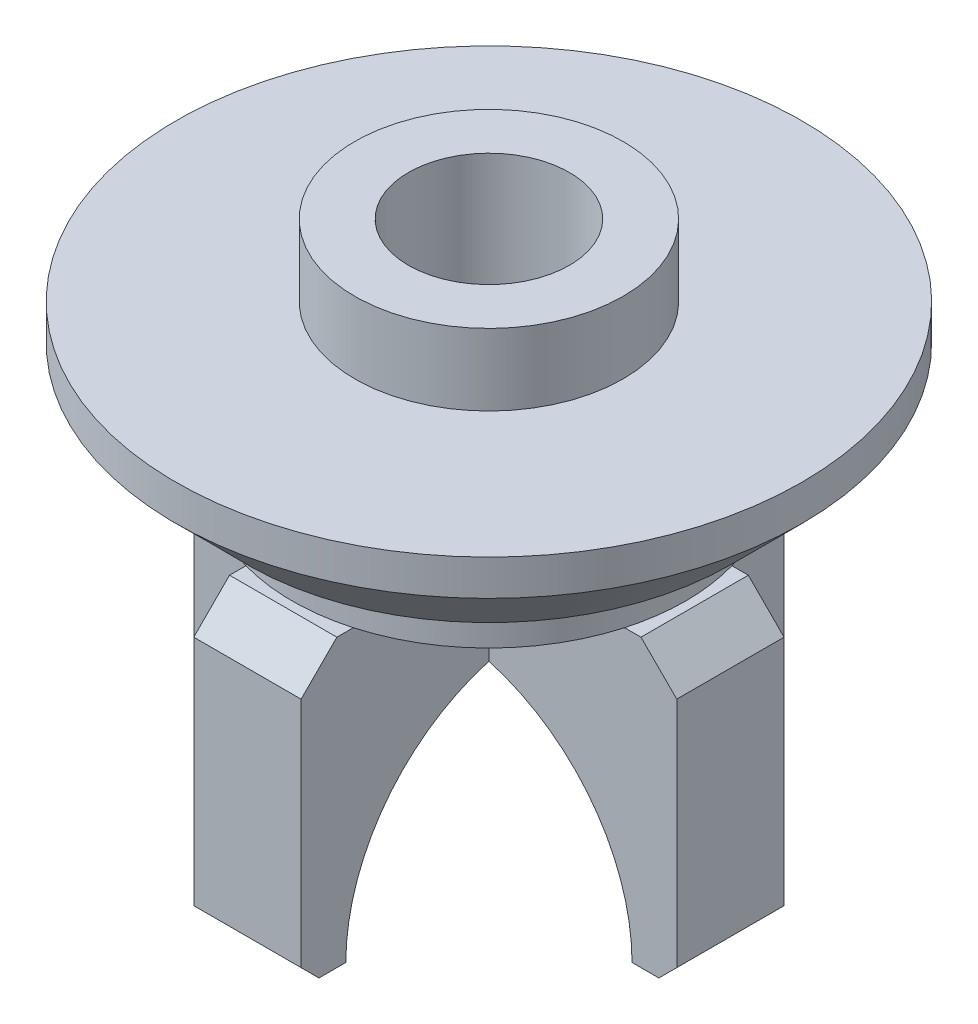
SolidWorks part; units mm, degrees
ref_plane "Front Plane" through (0, 0, 0) normal (0, 0, 1) x (1, 0, 0)
ref_plane "Top Plane" through (0, 0, 0) normal (0, 1, 0) x (1, 0, 0)
ref_plane "Right Plane" through (0, 0, 0) normal (1, 0, 0) x (0, 0, -1)
sketch "Sketch1" plane through (0, 0, 0) normal (0, 0, 1) x (1, 0, 0)
  line L0 (0, 0) -> (0, 23.9278) construction
  line L1 (0, 0) -> (24.5326, 0) construction
  line L2 (0, 0) -> (11, 0)
  line L3 (11, 0) -> (11, 3)
  line L4 (11, 3) -> (13.5, 3)
  line L5 (13.5, 3) -> (17.5, 7)
  line L6 (17.5, 7) -> (17.5, 9)
  line L7 (17.5, 9) -> (7.5, 9)
  line L8 (7.5, 9) -> (7.5, 13)
  line L9 (7.5, 13) -> (0, 13)
  line L10 (0, 0) -> (0, 13)
  dimension "D1" = 11
  dimension "D2" = 2.5
  dimension "D3" = 3
  dimension "D4" = 4
  dimension "D5" = 4
  dimension "D6" = 2
  dimension "D7" = 4
  dimension "D8" = 7.5
revolve "Revolve1" add sketch "Sketch1" angle 360 about L10
sketch "Sketch2" plane through (0, 0, 0) normal (0, 0, 1) x (1, 0, 0)
  line L0 (0, 0) -> (0, -5) construction
  line L1 (0, 0) -> (0, -5)
  line L2 (-13.5, -2) -> (-13.5, -15)
  line L3 (13.5, -2) -> (13.5, -15)
  line L4 (-11.5, 0) -> (11.5, 0)
  line L5 (-12.5, -16) -> (-11, -16)
  line L6 (11, -16) -> (12.5, -16)
  line L7 (0, 0) -> (0, -16) construction
  line L8 (13.5, 0) -> (13.5, -16) construction
  line L9 (11.5, 0) -> (13.5, -2)
  line L10 (-13.5, 0) -> (-13.5, -16) construction
  line L11 (-11.5, 0) -> (-13.5, -2)
  line L12 (-13.5, -15) -> (-12.5, -16)
  line L13 (12.5, -16) -> (13.5, -15)
  arc A0 (11, -16) -> (-11, -16) centre (0, -16) ccw
  dimension "D2" = 22
  dimension "D1" = 16
  dimension "D3" = 13.5
  dimension "D4" = 13.5
extrude "Boss-Extrude1" add sketch "Sketch2" along normal mid plane 6 contours A0 L1 L4 L11 L2 L12 L5 | A0 L6 L13 L3 L9 L4 L1
pattern_circular "CirPattern1" count 2 over 90 about axis through (0, 0, 0) along (0, 1, 0) of "Boss-Extrude1"
hole_wizard "Ø9.0 (9) Diameter Hole1" positions "Sketch3" profile "Sketch4" hole size "Ø9.0" standard "ANSI Metric"
sketch "Sketch3" plane through (0, 13, 0) normal (0, 1, 0) x (1, 0, 0)
  point P0 (0, 0)
sketch "Sketch4" plane through (0, 13, 0) normal (1, 0, 0) x (0, 0, 1)
  line L0 (0, 0) -> (0, 12.7039)
  line L1 (0, 12.7039) -> (4.5, 10)
  line L2 (4.5, 10) -> (4.5, 0)
  line L5 (4.5, 0) -> (0, 0)
  line L10 (0, 12.7039) -> (-4.5, 10) construction
  line L11 (0, -6.35) -> (0, 107.95) construction
  dimension "Hole Dia." = 9
  dimension "Hole Depth" = 10
  dimension "Drill Angle" = 118
